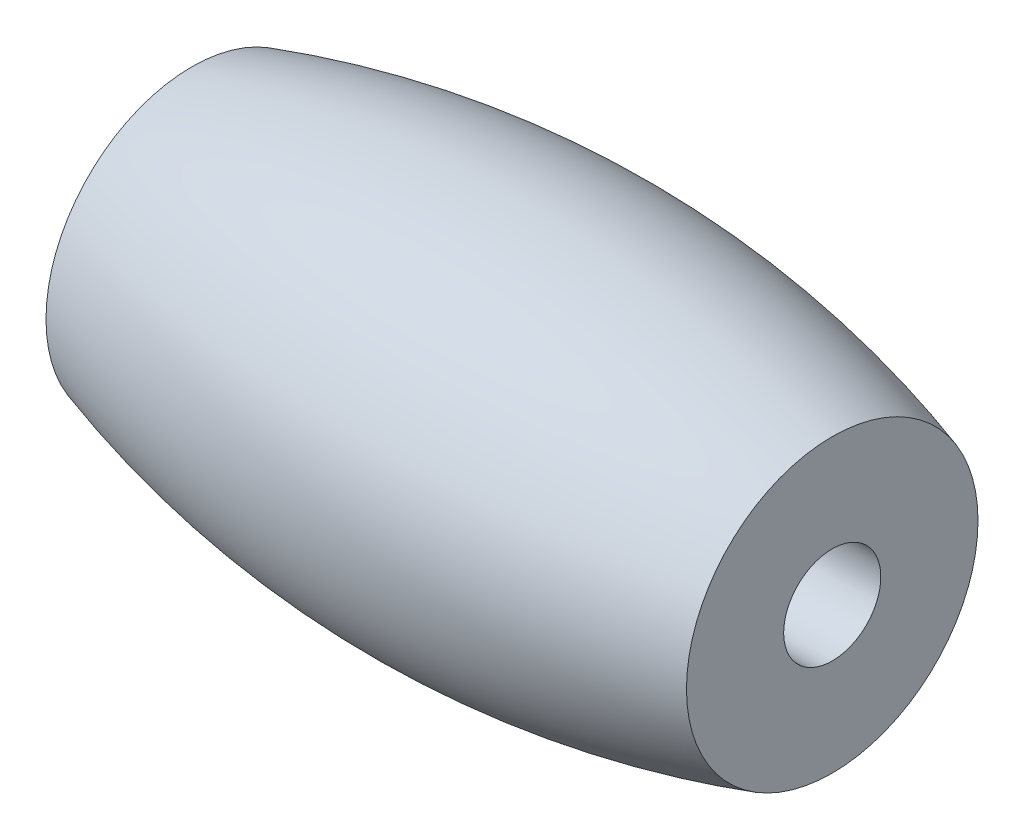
SolidWorks part; units mm, degrees
ref_plane "Front Plane" through (0, 0, 0) normal (0, 0, 1) x (1, 0, 0)
ref_plane "Top Plane" through (0, 0, 0) normal (0, 1, 0) x (1, 0, 0)
ref_plane "Right Plane" through (0, 0, 0) normal (1, 0, 0) x (0, 0, -1)
sketch "Sketch1" plane through (0, 0, 0) normal (0, 1, 0) x (1, 0, 0)
  line L0 (-7.25, 0) -> (7.25, 0)
  line L1 (-7.25, 0) -> (-7.25, -3.3)
  line L2 (7.25, 0) -> (7.25, -3.3)
  line L3 (0, 0) -> (0, -4.4) construction
  arc A0 (7.25, -3.3) -> (-7.25, -3.3) centre (0, 20.042) cw
  point P4 (0, 0)
  dimension "D2" = 24.442
  dimension "D1" = 3.3
revolve "Revolve1" add sketch "Sketch1" angle 360 about L0
sketch "Sketch2" plane through (-7.25, 0, 0) normal (-1, 0, 0) x (0, 0, 1)
  circle A0 centre (0, 0) radius 1.1
extrude "Cut-Extrude1" cut sketch "Sketch2" against normal through all
